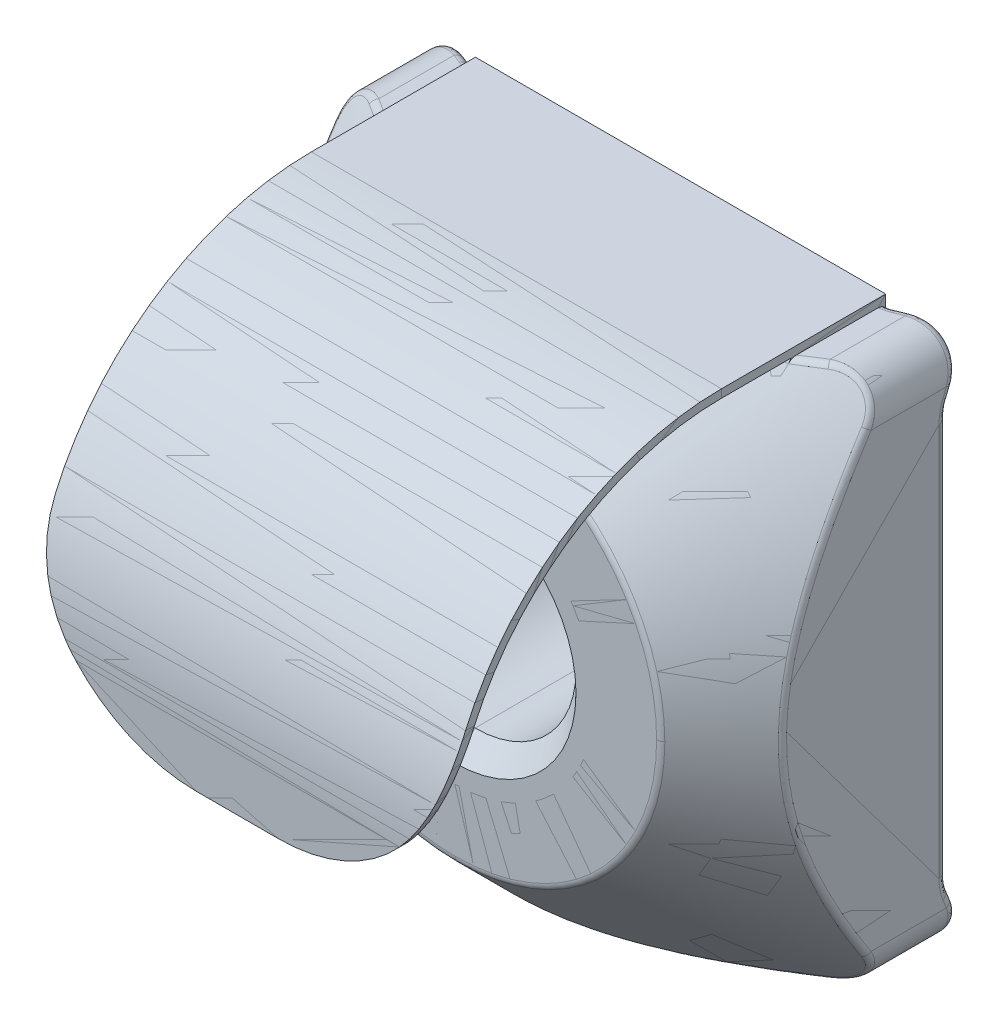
SolidWorks part; units mm, degrees
other "1.2129 Neliömutteri M6 kiinnityslevyllä ESD.STEP<1>[1]"
ref_plane "Front Plane" through (0, 0, 0) normal (0, 0, 1) x (1, 0, 0)
ref_plane "Top Plane" through (0, 0, 0) normal (0, 1, 0) x (1, 0, 0)
ref_plane "Right Plane" through (0, 0, 0) normal (1, 0, 0) x (0, 0, -1)
imported_body "1.2129 Neliömutteri M6 kiinnityslevyllä ESD.STEP<1>"
hole_wizard "M8 Tapped Hole1" positions "Sketch2" profile "Sketch4" tap size "M8" standard "ISO"
sketch "Sketch2" plane through (0, 0, 0) normal (0, 0, -1) x (-1, 0, 0)
  point P0 (0, 0)
sketch "Sketch4" plane through (0, 0, 0) normal (1, 0, 0) x (0, 1, 0)
  line L0 (0, 0) -> (0, 7.5429)
  line L1 (0, 7.5429) -> (3.4, 5.5)
  line L2 (3.4, 5.5) -> (3.4, 0.625)
  line L3 (3.4, 0.625) -> (4.025, 0)
  line L5 (4.025, 0) -> (0, 0)
  line L6 (-3.4, 0.625) -> (-4.025, 0) construction
  line L10 (0, 7.5429) -> (-3.4, 5.5) construction
  line L11 (0, -6.35) -> (0, 107.95) construction
  dimension "Tap Drill Dia." = 6.8
  dimension "Tap Drill Depth" = 5.5
  dimension "Near C'Sink Dia." = 8.05
  dimension "Near C'Sink Angle" = 90
  dimension "Drill Angle" = 118
